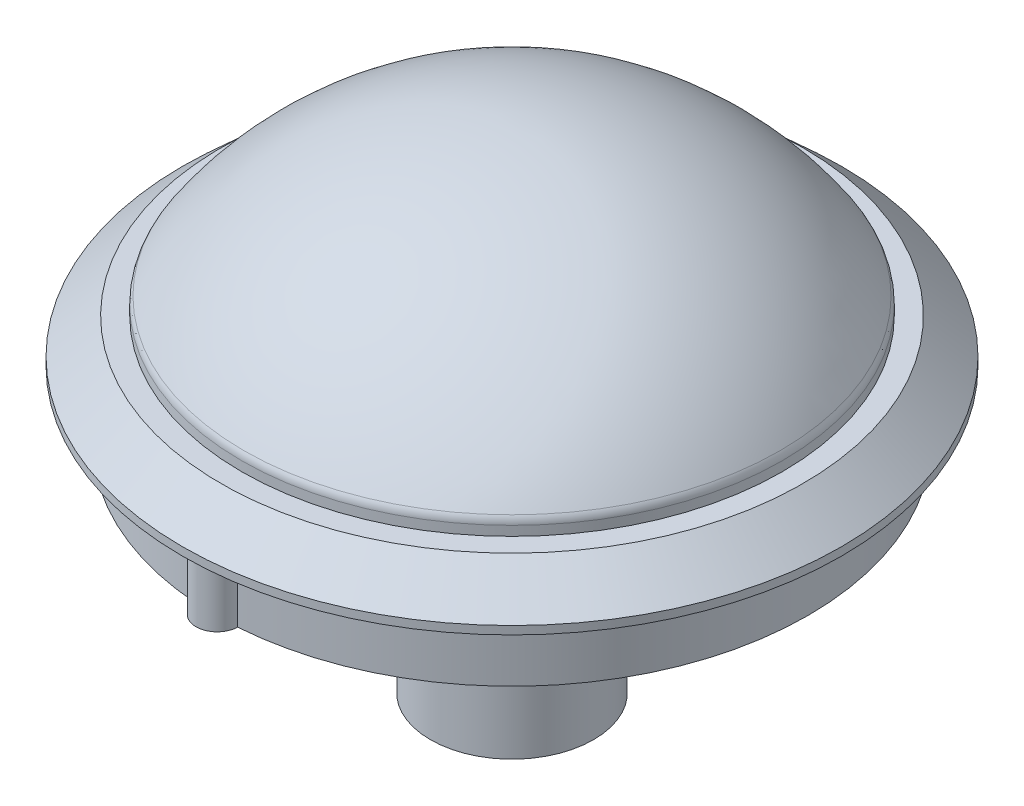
SolidWorks part; units mm, degrees
ref_plane "Plan de face" through (0, 0, 0) normal (0, 0, 1) x (1, 0, 0)
ref_plane "Plan de dessus" through (0, 0, 0) normal (0, 1, 0) x (1, 0, 0)
ref_plane "Plan de droite" through (0, 0, 0) normal (1, 0, 0) x (0, 0, -1)
sketch "Esquisse1" plane through (0, 0, 0) normal (0, 1, 0) x (1, 0, 0)
  line L0 (0, 101.301) -> (0, -77.0945) construction
  line L7 (76.844, 0) -> (-81.2306, 0) construction
  arc A0 (3.0987, -43.4396) -> (3.0987, 43.4396) centre (0, 0) ccw
  circle A1 centre (0, 0) radius 46.45 construction
  arc A2 (3.0987, 43.4396) -> (-3.0987, 43.4396) centre (0, 43.35) ccw
  arc A3 (3.0987, -43.4396) -> (-3.0987, -43.4396) centre (0, -43.35) cw
  arc A4 (-3.0987, 43.4396) -> (-3.0987, -43.4396) centre (0, 0) ccw
  point P42 (0, 0)
extrude "Boss.-Extru.1" add sketch "Esquisse1" along normal blind 10
ref_plane "Plan1" through (0, 0, 0) normal (1, 0, 0) x (0, 0, -1)
sketch "Esquisse2" plane through (0, 0, 0) normal (1, 0, 0) x (0, 0, -1)
  line L0 (0, -3.3554) -> (0, 28.712) construction
  line L1 (58.8887, 10) -> (-0.9889, 10) construction
  line L2 (43.4396, 10) -> (-43.4396, 10) construction
  line L3 (46.45, -6.2934) -> (46.45, 11.7527) construction
  line L4 (48.45, -6.2934) -> (48.45, 24.2503) construction
  line L5 (48.45, 11.2) -> (41.8467, 17.2508) construction
  line L6 (34.7137, 16.4) -> (58.8887, 16.4) construction
  line L7 (39.65, 24.2503) -> (39.65, 11.1684) construction
  line L8 (-0.9889, 12) -> (41.27, 12) construction
  line L9 (48.45, 11.2) -> (55.2914, 11.2) construction
  line L10 (39.65, 16.4) -> (42.7752, 16.4)
  line L11 (39.65, 16.4) -> (39.65, 12)
  line L12 (39.65, 12) -> (0, 12)
  line L13 (0, 12) -> (0, 10)
  line L14 (0, 10) -> (48.45, 10)
  line L15 (48.45, 10) -> (48.45, 11.2)
  line L16 (48.45, 11.2) -> (42.7752, 16.4)
  dimension "D1" = 2
  dimension "D2" = 2
  dimension "D3" = 6.4
  dimension "D4" = 1.2
  dimension "D5" = 8.8
  dimension "D6" = 47.5
revolve "Révolution1" add sketch "Esquisse2" angle 360 about L0
sketch "Esquisse3" plane through (0, 0, 0) normal (0, -1, 0) x (1, 0, 0)
  circle A0 centre (0, 0) radius 12
extrude "Boss.-Extru.2" add sketch "Esquisse3" along normal blind 31.6
sketch "Esquisse4" plane through (0, 0, 0) normal (1, 0, 0) x (0, 0, -1)
  line L0 (0, 50.7901) -> (0, -24.0006) construction
  line L1 (57.3106, 10) -> (-3.0776, 10) construction
  line L2 (54.7655, 12) -> (-6.7024, 12) construction
  line L3 (-39.75, 18.4) -> (39.75, 18.4) construction
  line L4 (72.8838, 0) -> (-3.0776, 0) construction
  line L5 (-43.4396, 0) -> (43.4396, 0) construction
  line L6 (72.8838, 40) -> (-18.593, 40) construction
  line L7 (39.75, 59.4734) -> (39.75, 7.4453) construction
  line L8 (-39.75, 59.4734) -> (-39.75, 14.0932) construction
  line L9 (39.75, 18.4) -> (39.75, 12)
  line L10 (39.75, 12) -> (0, 12)
  line L11 (0, 12) -> (0, 40)
  arc A0 (39.75, 18.4) -> (0, 40) centre (0, -7.3755) ccw
  dimension "D1" = 40
  dimension "D2" = 2
  dimension "D3" = 8.4
  dimension "D4" = 39.75
  dimension "D5" = 79.5
revolve "Révolution2" add sketch "Esquisse4" angle 360 about L11
fillet "Congé1" radius 2 1 edges at (0, 18.4, -39.75)
